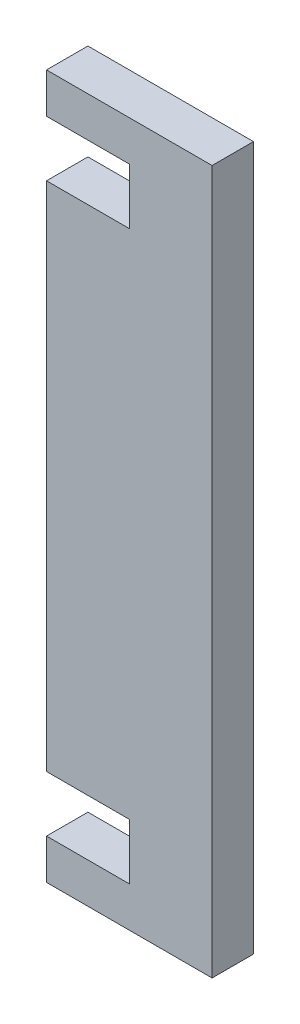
SolidWorks part; units mm, degrees
ref_plane "Plan de face" through (0, 0, 0) normal (0, 0, 1) x (1, 0, 0)
ref_plane "Plan de dessus" through (0, 0, 0) normal (0, 1, 0) x (1, 0, 0)
ref_plane "Plan de droite" through (0, 0, 0) normal (1, 0, 0) x (0, 0, -1)
sketch "Esquisse1" plane through (0, 0, 0) normal (0, 0, 1) x (1, 0, 0)
  line L1 (0, 0) -> (40, 0)
  line L2 (0, 0) -> (0, 170)
  line L3 (0, 170) -> (40, 170)
  line L4 (40, 0) -> (40, 170)
  dimension "D1" = 170
  dimension "D2" = 40
extrude "Boss.-Extru.1" add sketch "Esquisse1" along normal blind 10
sketch "Esquisse2" plane through (0, 0, 10) normal (0, 0, 1) x (1, 0, 0)
  line L0 (0, 85) -> (43.8819, 85) construction
  line L1 (0, 170) -> (0, 0) construction
  line L2 (20, 9.7) -> (20, 23.2)
  line L3 (0, 160.3) -> (20, 160.3)
  line L4 (0, 160.3) -> (0, 146.8)
  line L5 (0, 146.8) -> (20, 146.8)
  line L6 (20, 160.3) -> (20, 146.8)
  line L7 (0, 23.2) -> (20, 23.2)
  line L8 (0, 9.7) -> (0, 23.2)
  line L9 (0, 9.7) -> (20, 9.7)
  dimension "D1" = 20
  dimension "D2" = 13.5
  dimension "D3" = 61.8
extrude "Enlèv. mat.-Extru.1" cut sketch "Esquisse2" against normal blind 10
